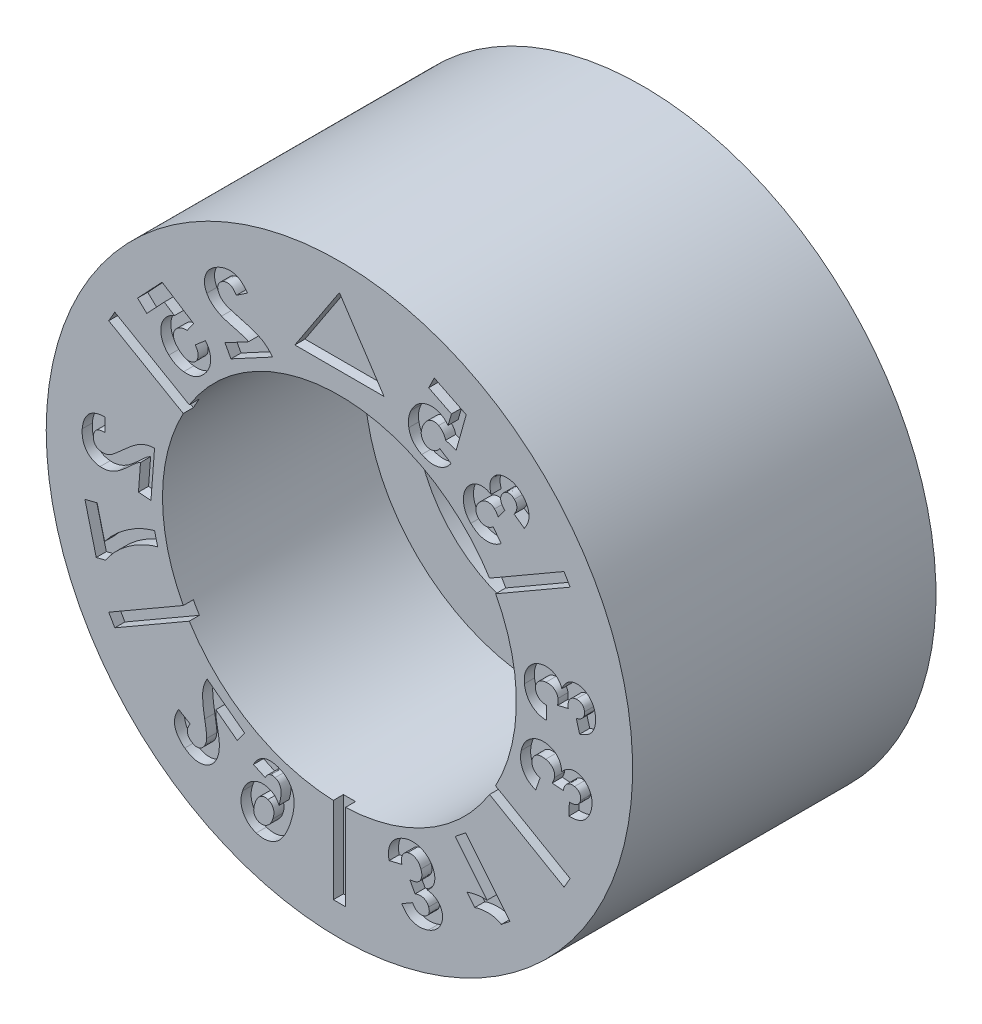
SolidWorks part; units mm, degrees
ref_plane "Front Plane" through (0, 0, 0) normal (0, 0, 1) x (1, 0, 0)
ref_plane "Top Plane" through (0, 0, 0) normal (0, 1, 0) x (1, 0, 0)
ref_plane "Right Plane" through (0, 0, 0) normal (1, 0, 0) x (0, 0, -1)
imported_body "Imported1"
other "Move Face2" parameters "D1"=0.157
other "DeleteFace1"
sketch "Sketch1" plane through (0, 0, 0) normal (0, 0, 1) x (1, 0, 0)
  line L0 (0, 0) -> (0, -3.3409) construction
  line L1 (0, 0) -> (-1.6705, -2.8933) construction
  line L3 (-0.06, -1.5) -> (0.06, -1.5)
  line L4 (-0.06, -1.5) -> (-0.06, -2.6)
  line L5 (-0.06, -2.6) -> (0.06, -2.6)
  line L6 (0.06, -1.5) -> (0.06, -2.6)
  line L11 (0, 0) -> (-2.8933, -1.6705) construction
  line L12 (-1.329, -0.698) -> (-1.269, -0.802)
  line L13 (-1.269, -0.802) -> (-2.2217, -1.352)
  line L14 (-1.329, -0.698) -> (-2.2817, -1.248)
  line L15 (-2.2817, -1.248) -> (-2.2217, -1.352)
  line L16 (0, 0) -> (-3.3409, 0) construction
  line L21 (0, 0) -> (-2.8933, 1.6705) construction
  line L22 (-1.269, 0.802) -> (-1.329, 0.698)
  line L23 (-1.329, 0.698) -> (-2.2817, 1.248)
  line L24 (-1.269, 0.802) -> (-2.2217, 1.352)
  line L25 (-2.2217, 1.352) -> (-2.2817, 1.248)
  line L26 (0, 0) -> (-1.6705, 2.8933) construction
  line L31 (0, 0) -> (0, 3.3409) construction
  line L36 (0, 0) -> (1.6705, 2.8933) construction
  line L41 (0, 0) -> (2.8933, 1.6705) construction
  line L42 (1.329, 0.698) -> (1.269, 0.802)
  line L43 (1.269, 0.802) -> (2.2217, 1.352)
  line L44 (1.329, 0.698) -> (2.2817, 1.248)
  line L45 (2.2817, 1.248) -> (2.2217, 1.352)
  line L46 (0, 0) -> (3.3409, 0) construction
  line L51 (0, 0) -> (2.8933, -1.6705) construction
  line L52 (1.269, -0.802) -> (1.329, -0.698)
  line L53 (1.329, -0.698) -> (2.2817, -1.248)
  line L54 (1.269, -0.802) -> (2.2217, -1.352)
  line L55 (2.2217, -1.352) -> (2.2817, -1.248)
  line L56 (0, 0) -> (1.6705, -2.8933) construction
  line L61 (0.06, 1.5) -> (0.06, 2.6)
  line L62 (-0.06, 1.5) -> (-0.06, 2.6)
  line L63 (0.06, 1.5) -> (-0.06, 1.5)
  line L64 (0.06, 2.6) -> (-0.06, 2.6)
  line L65 (0.802, 1.269) -> (1.352, 2.2217)
  line L66 (0.698, 1.329) -> (1.248, 2.2817)
  line L67 (1.352, 2.2217) -> (1.248, 2.2817)
  line L68 (0.802, 1.269) -> (0.698, 1.329)
  line L69 (-0.698, 1.329) -> (-1.248, 2.2817)
  line L70 (-1.248, 2.2817) -> (-1.352, 2.2217)
  line L71 (-0.802, 1.269) -> (-1.352, 2.2217)
  line L72 (-0.698, 1.329) -> (-0.802, 1.269)
  line L73 (1.5, 0.06) -> (2.6, 0.06)
  line L74 (1.5, -0.06) -> (2.6, -0.06)
  line L75 (1.5, -0.06) -> (1.5, 0.06)
  line L76 (2.6, -0.06) -> (2.6, 0.06)
  line L77 (-1.5, 0.06) -> (-2.6, 0.06)
  line L78 (-1.5, -0.06) -> (-2.6, -0.06)
  line L79 (-1.5, 0.06) -> (-1.5, -0.06)
  line L80 (-2.6, 0.06) -> (-2.6, -0.06)
  line L81 (0.802, -1.269) -> (1.352, -2.2217)
  line L82 (0.698, -1.329) -> (1.248, -2.2817)
  line L83 (-0.698, -1.329) -> (-1.248, -2.2817)
  line L84 (-0.802, -1.269) -> (-1.352, -2.2217)
  line L85 (-0.802, -1.269) -> (-0.698, -1.329)
  line L86 (0.698, -1.329) -> (0.802, -1.269)
  line L87 (1.248, -2.2817) -> (1.352, -2.2217)
  line L88 (-1.352, -2.2217) -> (-1.248, -2.2817)
  arc A0 (-0.6417, 1.7581) -> (0, 1.8715) centre (0, 0) ccw construction
  text T0 "25  27  29  31  33  35" font "Arial" height 0.7
  point P66 (0, 0)
  dimension "D1" = 3.743
  dimension "D6" = 12
extrude "Cut-Extrude1" cut sketch "Sketch1" against normal blind 0.1
